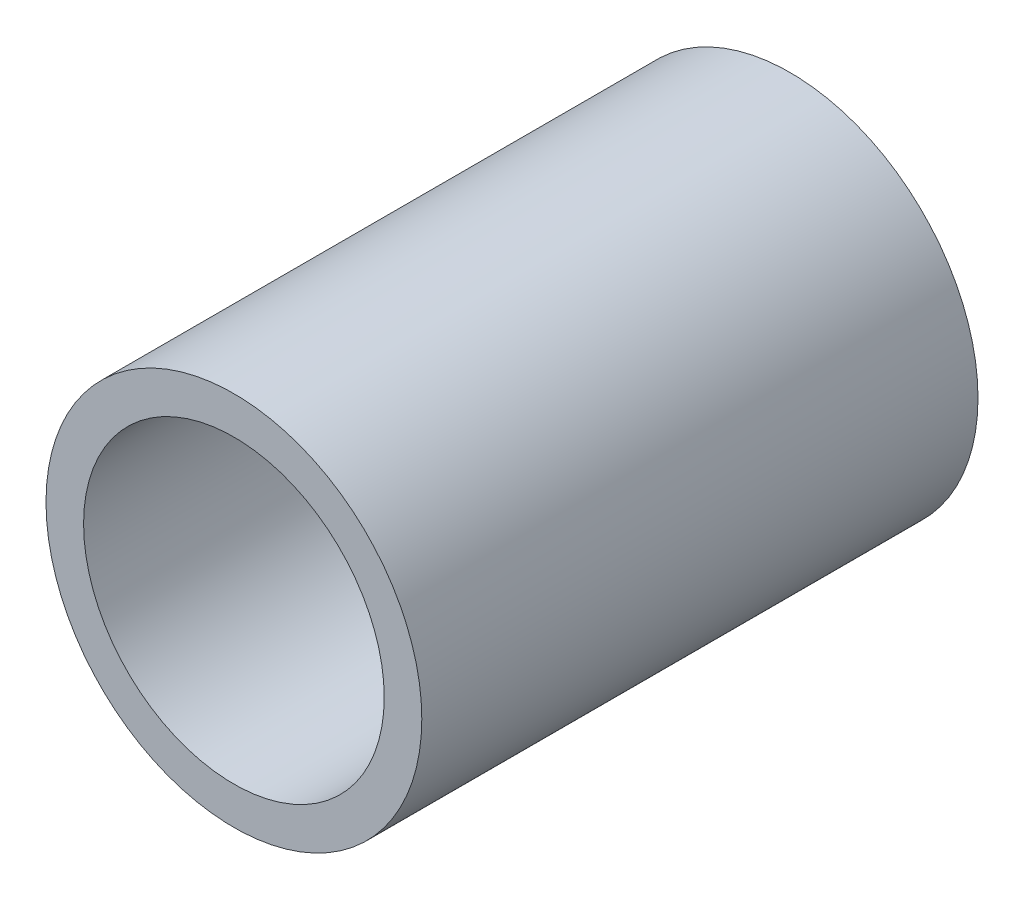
SolidWorks part; units mm, degrees
ref_plane "Plan de face" through (0, 0, 0) normal (0, 0, 1) x (1, 0, 0)
ref_plane "Plan de dessus" through (0, 0, 0) normal (0, 1, 0) x (1, 0, 0)
ref_plane "Plan de droite" through (0, 0, 0) normal (1, 0, 0) x (0, 0, -1)
sketch "Esquisse1" plane through (0, 0, 0) normal (0, 0, 1) x (1, 0, 0)
  circle A0 centre (0, 0) radius 12.5
  circle A1 centre (0, 0) radius 10
  dimension "D2" = 20
  dimension "D1" = 25
extrude "Extrusion1" add sketch "Esquisse1" along normal blind 37
